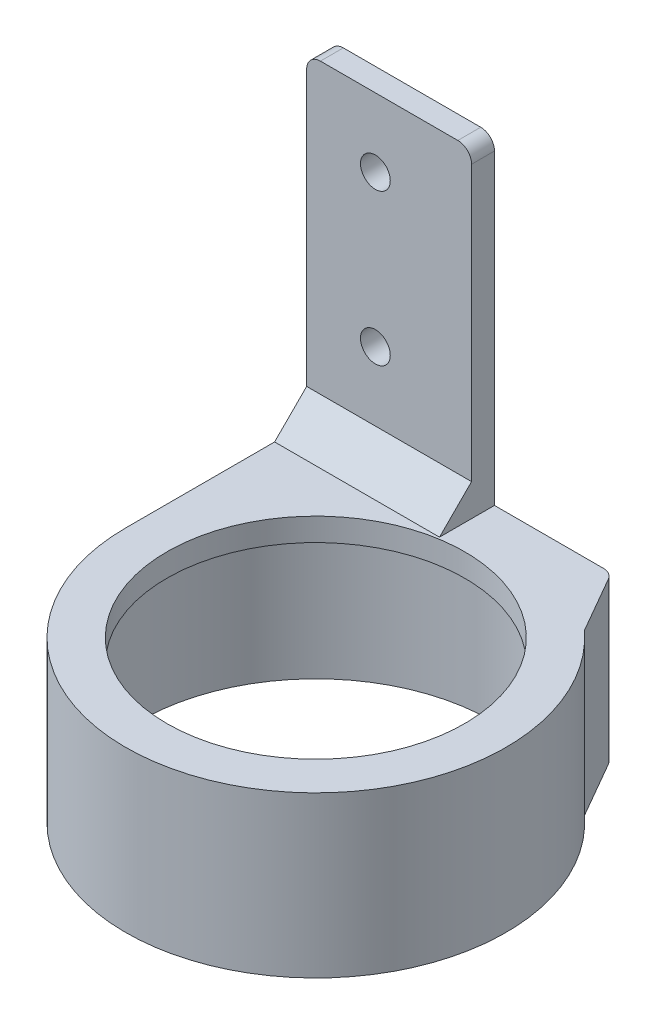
SolidWorks part; units mm, degrees
ref_plane "Ebene vorne" through (0, 0, 0) normal (0, 0, 1) x (1, 0, 0)
ref_plane "Ebene oben" through (0, 0, 0) normal (0, 1, 0) x (1, 0, 0)
ref_plane "Ebene rechts" through (0, 0, 0) normal (1, 0, 0) x (0, 0, -1)
sketch "Skizze1" plane through (0, 0, 0) normal (0, 0, 1) x (1, 0, 0)
  line L0 (18, 0) -> (18, -105) construction
  line L1 (3, 0) -> (33, 0)
  line L2 (0, -3) -> (0, -97)
  line L3 (3, -105) -> (33, -105)
  line L4 (36, -3) -> (36, -97)
  line L5 (0, -63) -> (36, -63) construction
  line L6 (33, -105) -> (36, -105)
  line L7 (36, -105) -> (36, -97)
  line L8 (0, -97) -> (0, -105)
  line L9 (0, -105) -> (3, -105)
  circle A2 centre (15, -15) radius 3.25
  circle A3 centre (15, -48) radius 3.25
  arc A6 (3, 0) -> (0, -3) centre (3, -3) ccw
  arc A7 (33, 0) -> (36, -3) centre (33, -3) cw
  point P18 (36, -105)
  point P21 (0, 0)
  point P24 (36, 0)
  dimension "D3" = 15
  dimension "D4" = 15
  dimension "D5" = 6.5
  dimension "D6" = 6.5
  dimension "D7" = 15
  dimension "D1" = 36
  dimension "D2" = 105
  dimension "D8" = 42
  dimension "D9" = 15
extrude "Aufsatz-Linear austragen1" add sketch "Skizze1" along normal blind 3
sketch "Skizze4" plane through (0, -105, 0) normal (0, -1, 0) x (1, 0, 0)
  line L0 (0, 3) -> (36, 3) construction
  line L1 (0, -20.5722) -> (0, 101.0705) construction
  line L2 (41.5, 44.5) -> (-50.319, 44.5) construction
  circle A0 centre (41.5, 44.5) radius 41.5
  point P7 (0, 44.5)
other "AusrichtungGruppe1" parameters "D1"=51.6821, "D2"=82, "D3"=82
extrude "Aufsatz-Linear austragen2" add sketch "Skizze4" against normal blind 35 separate body
sketch "Skizze6" plane through (0, -105, 0) normal (0, -1, 0) x (-1, 0, 0)
  circle A0 centre (-41.5, -44.5) radius 38.5
  dimension "D1" = 77
extrude "Schnitt-Linear austragen1" cut sketch "Skizze6" against normal through all
sketch "Skizze7" plane through (0, -70, 0) normal (0, 1, 0) x (1, 0, 0)
  circle A0 centre (41.5, -44.5) radius 32.5
  dimension "D1" = 65
extrude "Linear-Austragen-Dünn1" add sketch "Skizze7" against normal blind 5 thin
sketch "Skizze16" plane through (0, 0, 0) normal (0, 0, -1) x (-1, 0, 0)
  line L0 (0, -70) -> (-83, -70) construction
  line L1 (-36, -105) -> (-61.5, -105)
  line L2 (-36, -105) -> (-36, -70)
  line L3 (-36, -70) -> (-61.5, -70)
  line L4 (-61.5, -105) -> (-61.5, -70)
  dimension "D1" = 25.5
extrude "Aufsatz-Linear austragen3" add sketch "Skizze16" against normal blind 3
sketch "Skizze17" plane through (0, -105, 0) normal (0, -1, 0) x (1, 0, 0)
  line L0 (41.5, 12) -> (41.5, -5.5591) construction
  line L2 (65.4633, 10.6177) -> (69.4531, 13.8263)
  line L3 (61.1577, 7.9511) -> (65.4633, 10.6177)
  line L4 (56.4564, 5.7888) -> (61.1577, 7.9511)
  line L5 (51.631, 4.2556) -> (56.4564, 5.7888)
  line L6 (46.5811, 3.3122) -> (51.631, 4.2556)
  line L7 (46.5811, 3.3122) -> (41.5, 3)
  line L8 (0, 3) -> (61.5, 3) construction
  line L10 (61.5, 3) -> (41.5, 3)
  line L11 (69.4531, 13.8263) -> (61.5, 0)
  line L12 (61.5, 0) -> (61.5, 3)
  line L13 (41.5, 3) -> (61.5, 3)
  circle A0 centre (41.5, 44.5) radius 32.5 construction
  circle A1 centre (41.5, 44.5) radius 41.5 construction
  point P10 (46.5811, 3.3122)
  point P11 (51.631, 4.2556)
  point P12 (56.4564, 5.7888)
  point P13 (61.1577, 7.9511)
  point P14 (65.4633, 10.6177)
extrude "Aufsatz-Linear austragen4" add sketch "Skizze17" against normal blind 35
sketch "Skizze19" plane through (0, -105, 0) normal (0, -1, 0) x (1, 0, 0)
  line L2 (0, 44.5) -> (0.2928, 39.5792)
  line L3 (0.2928, 39.5792) -> (1.3201, 34.116)
  line L4 (1.3201, 34.116) -> (2.9875, 29.0393)
  line L5 (2.9875, 29.0393) -> (5.4052, 24.0204)
  line L6 (5.4052, 24.0204) -> (8.4399, 19.4145)
  line L7 (8.4399, 19.4145) -> (12.0006, 15.3103)
  line L8 (12.0006, 15.3103) -> (16.1589, 11.6355)
  line L9 (16.1589, 11.6355) -> (20.6222, 8.6341)
  line L10 (20.6222, 8.6341) -> (25.5345, 6.1939)
  line L11 (25.5345, 6.1939) -> (30.6999, 4.43)
  line L12 (30.6999, 4.43) -> (36.0384, 3.361)
  line L13 (36.0384, 3.361) -> (41.5, 3)
  line L14 (0, 3) -> (0, 44.5)
  line L15 (41.5, 3) -> (0, 3)
  circle A0 centre (41.5, 44.5) radius 41.5 construction
  point P7 (36.0384, 3.361)
  point P10 (30.6999, 4.43)
  point P11 (25.5345, 6.1939)
  point P12 (20.6222, 8.6341)
  point P13 (16.1589, 11.6355)
  point P14 (12.0006, 15.3103)
  point P15 (8.4399, 19.4145)
  point P16 (5.4052, 24.0204)
  point P17 (2.9875, 29.0393)
  point P18 (1.2971, 34.2053)
  point P19 (0.2928, 39.5792)
extrude "Aufsatz-Linear austragen5" add sketch "Skizze19" against normal blind 35
sketch3d "3D-Skizze1"
  point P0 (41.7889, -78.459, 85.999)
ref_plane "Ebene1" through (0, 0, 85.999) normal (0, 0, 1) x (1, 0, 0)
sketch "Skizze20" plane through (0, 0, 85.999) normal (0, 0, 1) x (1, 0, 0)
  line L0 (83, -70) -> (0, -70) construction
  line L3 (0, -105) -> (83, -105) construction
  line L5 (-44.701, -98) -> (109.682, -98) construction
  line L31 (-30.7141, -77) -> (172.708, -77) construction
  line L32 (-23.44, -98) -> (16.56, -98)
  line L57 (16.56, -98) -> (-3.44, -77)
  line L64 (21.56, -77) -> (21.56, -98) construction
  line L65 (-3.44, -77) -> (-23.44, -98)
  line L67 (-3.44, -77) -> (-3.44, -98) construction
  line L74 (21.56, -98) -> (41.56, -77)
  line L75 (41.56, -77) -> (1.56, -77)
  line L76 (1.56, -77) -> (21.56, -98)
  line L90 (66.56, -98) -> (26.56, -98)
  line L91 (26.56, -98) -> (46.56, -77)
  line L92 (46.56, -77) -> (46.56, -98) construction
  line L93 (46.56, -77) -> (66.56, -98)
  line L94 (51.56, -77) -> (91.56, -77)
  line L95 (71.56, -98) -> (51.56, -77)
  line L96 (71.56, -77) -> (71.56, -98) construction
  line L97 (91.56, -77) -> (71.56, -98)
  line L98 (76.56, -98) -> (116.56, -98)
  line L99 (96.56, -77) -> (76.56, -98)
  line L100 (96.56, -77) -> (96.56, -98) construction
  line L101 (116.56, -98) -> (96.56, -77)
  line L102 (141.56, -77) -> (101.56, -77)
  line L103 (101.56, -77) -> (121.56, -98)
  line L104 (121.56, -77) -> (121.56, -98) construction
  line L105 (121.56, -98) -> (141.56, -77)
  line L106 (126.56, -98) -> (141.56, -98)
  line L107 (126.56, -98) -> (146.56, -77)
  line L108 (146.56, -77) -> (146.56, -98)
  line L109 (146.56, -98) -> (141.56, -98)
  dimension "D1" = 7
  dimension "D2" = 40
  dimension "D3" = 5
  dimension "D4" = 7
  dimension "D5" = 5
  dimension "D6" = 40
  dimension "D7" = 5
  dimension "D8" = 5
wrap "Umwickeln1" [suppressed] sketch "Skizze20" source sketch "Skizze20" thickness 5 parameters "D1"=5
sketch "Skizze21" plane through (0, -70, 0) normal (0, 1, 0) x (1, 0, 0)
  line L10 (55.4486, 0) -> (59.7647, 0)
  line L11 (36, 0) -> (61.5, 0) construction
  line L12 (62.3652, -1.5042) -> (64.3465, -4.9487)
  line L13 (69.4531, -13.8263) -> (61.5, 0) construction
  line L14 (64.3465, -4.9487) -> (55.4486, 0)
  line L15 (59.7647, 0) -> (61.5, 0)
  line L16 (61.5, 0) -> (62.3652, -1.5042)
  arc A0 (59.7647, 0) -> (62.3652, -1.5042) centre (59.7647, -3) cw
  point P12 (61.5, 0)
  dimension "D1" = 3
extrude "Schnitt-Linear austragen3" cut sketch "Skizze21" against normal through all contours A0 M4 M3
sketch "Skizze23" plane through (0, 0, 0) normal (0, 0, -1) x (-1, 0, 0)
  line L0 (-15, -15) -> (-15, -48) construction
  line L1 (-36, -70) -> (0, -70) construction
sketch "Skizze24" [suppressed] plane through (0, 0, 0) normal (-1, 0, 0) x (0, 0, 1)
  line L0 (79.7239, -125) -> (0, -125) construction
  line L1 (0, -3) -> (0, -132) construction
  line L2 (0, -74) -> (77.1095, -74) construction
  line L9 (78.7288, -125) -> (44.748, -125) construction
  line L10 (68.2191, -74) -> (86, -74) construction
  line L11 (19.748, -74) -> (59.748, -74)
  line L15 (19.748, -74) -> (39.748, -125)
  line L16 (39.748, -125) -> (59.748, -74)
  line L18 (39.748, -125) -> (39.748, -74) construction
  line L19 (14.748, -74) -> (14.748, -125)
  line L20 (14.748, -74) -> (34.748, -125)
  line L21 (14.748, -125) -> (34.748, -125)
  point P12 (14.748, -74)
  dimension "D1" = 5
  dimension "D2" = 20
  dimension "D3" = 20
  dimension "D4" = 4.2062
  dimension "D5" = 5
  dimension "D6" = 5
extrude "Schnitt-Linear austragen4" [suppressed] cut sketch "Skizze24" against normal blind 15
sketch "Skizze29" plane through (0, 0, 3) normal (0, 0, 1) x (1, 0, 0)
  line L1 (3, 0) -> (33, 0)
  line L2 (0, -3) -> (0, -70)
  line L3 (0, -70) -> (36, -70)
  line L4 (36, -3) -> (36, -70)
  arc A0 (33, 0) -> (36, -3) centre (33, -3) cw
  arc A1 (3, 0) -> (0, -3) centre (3, -3) ccw
  circle A2 centre (15, -15) radius 3.25
  circle A3 centre (15, -48) radius 3.25
  point P10 (0, 0)
  dimension "D1" = 3
extrude "Aufsatz-Linear austragen8" add sketch "Skizze29" along normal blind 2
sketch "Skizze26" plane through (0, 0, 0) normal (-1, 0, 0) x (0, 0, 1)
  line L5 (5, -70) -> (5, -63)
  line L6 (5, -3) -> (5, -70) construction
  line L7 (5, -70) -> (12, -70)
  line L8 (44.5, -70) -> (5, -70) construction
  line L9 (5, -63) -> (12, -70)
  dimension "D1" = 7
  dimension "D2" = 7
extrude "Aufsatz-Linear austragen6" add sketch "Skizze26" against normal blind 36
